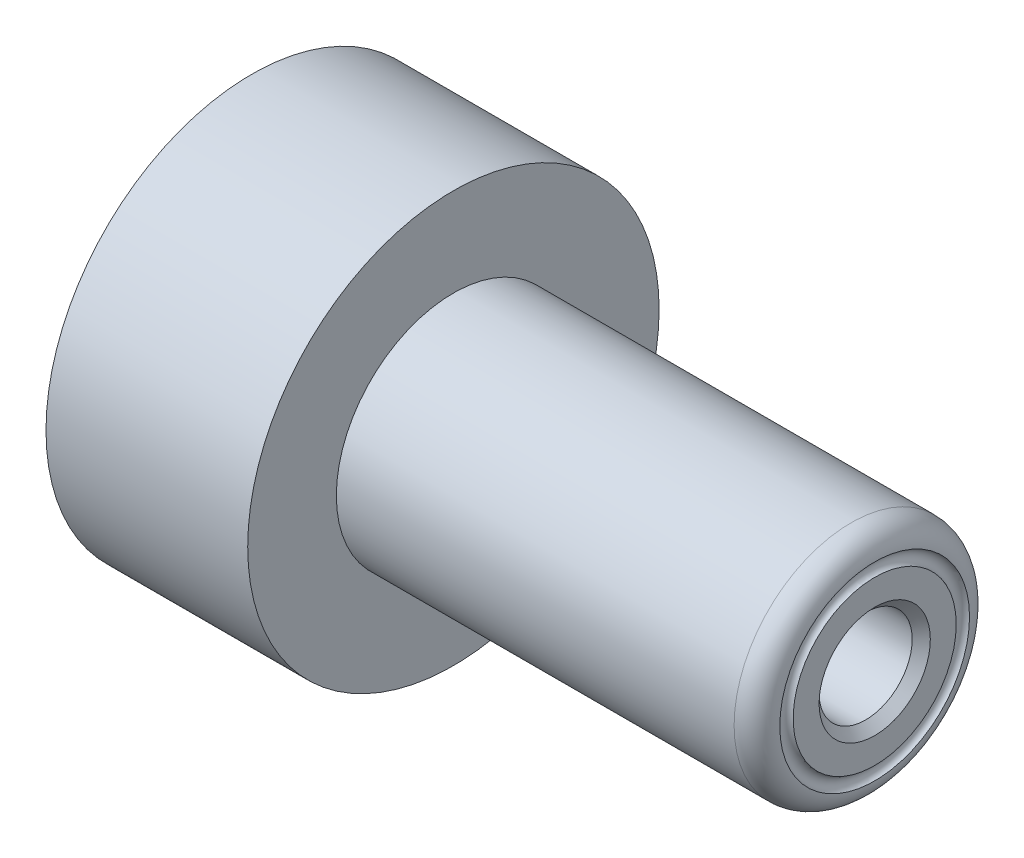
SolidWorks part; units mm, degrees
ref_plane "Front Plane" through (0, 0, 0) normal (0, 0, 1) x (1, 0, 0)
ref_plane "Top Plane" through (0, 0, 0) normal (0, 1, 0) x (1, 0, 0)
ref_plane "Right Plane" through (0, 0, 0) normal (1, 0, 0) x (0, 0, -1)
sketch "Sketch1" plane through (0, 0, 0) normal (0, 0, 1) x (1, 0, 0)
  line L0 (0, 0) -> (102.3864, 0) construction
  line L1 (0, 3.9751) -> (0, 11.1125)
  line L2 (0, 11.1125) -> (10.8966, 11.1125)
  line L3 (10.8966, 11.1125) -> (10.8966, 6.3246)
  line L4 (10.8966, 6.3246) -> (32.385, 6.3246)
  line L5 (33.655, 5.0546) -> (33.655, 0)
  line L6 (33.655, 0) -> (21.8948, 0)
  line L7 (0, 3.9751) -> (21.8948, 3.9751)
  line L8 (21.8948, 3.9751) -> (21.8948, 0)
  arc A0 (33.655, 5.0546) -> (32.385, 6.3246) centre (32.385, 5.0546) ccw
  dimension "D5" = 1.27
  dimension "D1" = 10.8966
  dimension "D2" = 22.225
  dimension "D3" = 21.8948
  dimension "D4" = 7.9502
  dimension "D6" = 33.655
  dimension "D7" = 12.6492
revolve "Revolve1" add sketch "Sketch1" angle 360 about L0
sketch "Sketch2" plane through (0, 0, 0) normal (-1, 0, 0) x (0, 0, 1)
  line L0 (0, 0) -> (0, 9.7644) construction
  circle A0 centre (-6.7437, 0) radius 1.2065
  circle A1 centre (6.7437, 0) radius 1.2065
  dimension "D2" = 2.413
  dimension "D1" = 13.4874
extrude "Cut-Extrude1" cut sketch "Sketch2" against normal blind 2.54
sketch "Sketch3" plane through (33.655, 0, 0) normal (1, 0, 0) x (0, 0, -1)
  circle A0 centre (0, 0) radius 2.515
  dimension "D1" = 5.03
extrude "Cut-Extrude2" cut sketch "Sketch3" against normal through all
chamfer "Chamfer1" distance 0.49 angle 45 1 edges at (33.655, 0, -2.515)
sketch "Sketch4" plane through (0, 0, 0) normal (0, 0, 1) x (1, 0, 0)
  line L0 (0, 0) -> (36.002, 0) construction
  line L3 (33.655, -5.0546) -> (33.655, 5.0546) construction
  circle A0 centre (33.778, 4.765) radius 0.381
  dimension "D1" = 9.53
  dimension "D2" = 0.123
  dimension "D3" = 0.381
revolve "Cut-Revolve1" cut sketch "Sketch4" angle 360 about L0
